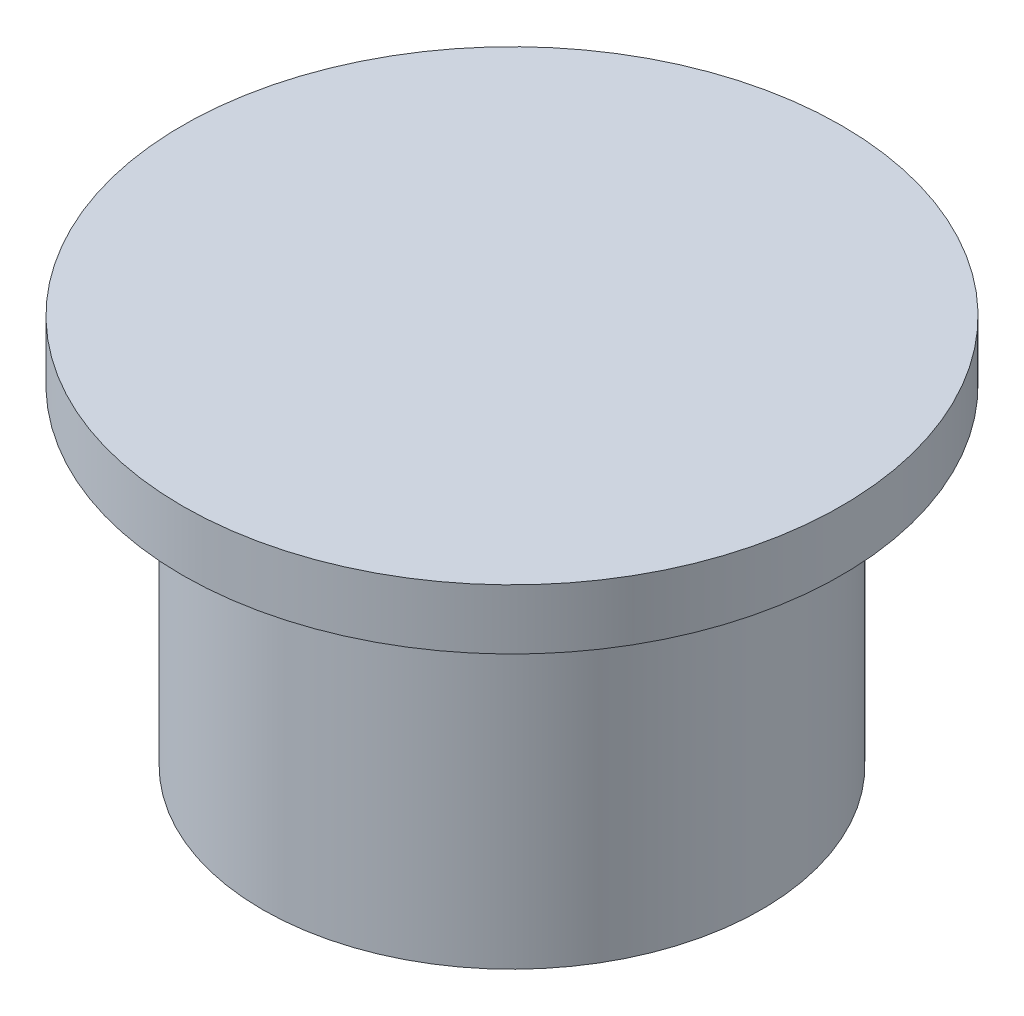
SolidWorks part; units mm, degrees
ref_plane "Plan de face" through (0, 0, 0) normal (0, 0, 1) x (1, 0, 0)
ref_plane "Plan de dessus" through (0, 0, 0) normal (0, 1, 0) x (1, 0, 0)
ref_plane "Plan de droite" through (0, 0, 0) normal (1, 0, 0) x (0, 0, -1)
sketch "Esquisse1" plane through (0, 0, 0) normal (0, 1, 0) x (1, 0, 0)
  circle A0 centre (0, 0) radius 8.33
  dimension "D1" = 16.66
extrude "Extrusion1" add sketch "Esquisse1" along normal blind 11
sketch "Esquisse2" plane through (0, 11, 0) normal (0, 1, 0) x (1, 0, 0)
  circle A0 centre (0, 0) radius 11
  dimension "D1" = 22
extrude "Extrusion2" add sketch "Esquisse2" along normal blind 2
